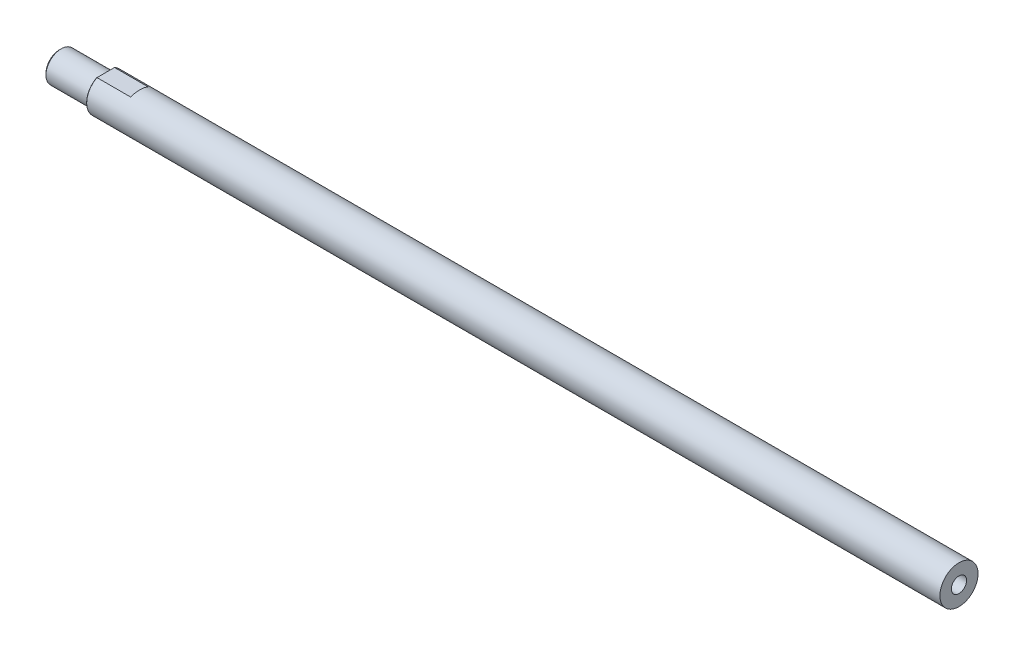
SolidWorks part; units mm, degrees
ref_plane "Front Plane" through (0, 0, 0) normal (0, 0, 1) x (1, 0, 0)
ref_plane "Top Plane" through (0, 0, 0) normal (0, 1, 0) x (1, 0, 0)
ref_plane "Right Plane" through (0, 0, 0) normal (1, 0, 0) x (0, 0, -1)
sketch "Sketch1" plane through (0, 0, 0) normal (0, 0, 1) x (1, 0, 0)
  line L0 (-34.7534, 0) -> (143.7331, 0) construction
  line L1 (-19.05, 6.35) -> (0, 6.35)
  line L2 (0, 6.35) -> (0, 7.9375)
  line L3 (0, 7.9375) -> (355.6, 7.9375)
  line L4 (355.6, 7.9375) -> (355.6, 0)
  line L5 (355.6, 0) -> (-19.05, 0)
  line L6 (-19.05, 0) -> (-19.05, 6.35)
  dimension "D1" = 12.7
  dimension "D2" = 15.875
  dimension "D3" = 19.05
  dimension "D4" = 355.6
revolve "Revolve1" add sketch "Sketch1" angle 360 about L0
hole_wizard "5/16-24 Tapped Hole1" positions "Sketch3" profile "Sketch2" tap size "5/16-24" standard "ANSI Inch"
sketch "Sketch3" plane through (-19.05, 0, 0) normal (-1, 0, 0) x (0, 0, 1)
  point P0 (0, 0)
sketch "Sketch2" plane through (-19.05, 0, 0) normal (0, 1, 0) x (0, 0, 1)
  line L0 (0, 0) -> (0, 17.9506)
  line L1 (0, 17.9506) -> (3.4544, 15.875)
  line L2 (3.4544, 15.875) -> (3.4544, 0)
  line L5 (3.4544, 0) -> (0, 0)
  line L10 (0, 17.9506) -> (-3.4544, 15.875) construction
  line L11 (0, -6.35) -> (0, 107.95) construction
  dimension "Tap Drill Dia." = 6.9088
  dimension "Tap Drill Depth" = 15.875
  dimension "Drill Angle" = 118
sketch "Sketch5" plane through (355.6, 0, 0) normal (1, 0, 0) x (0, 0, -1)
  circle A0 centre (0, 0) radius 3.175
  dimension "D1" = 6.35
extrude "Cut-Extrude1" cut sketch "Sketch5" against normal through all
sketch "Sketch6" plane through (0, 0, 0) normal (0, 0, 1) x (1, 0, 0)
  line L0 (0, 7.0485) -> (14.224, 7.0485)
  line L1 (0, 7.9375) -> (0, -7.9375) construction
  line L2 (14.224, 7.0485) -> (14.4622, 7.9375)
  line L3 (355.6, 7.9375) -> (0, 7.9375) construction
  line L4 (14.4622, 7.9375) -> (0, 7.9375)
  line L5 (0, 7.9375) -> (0, 7.0485)
  line L6 (0, -7.9375) -> (355.6, -7.9375) construction
  dimension "D1" = 75
  dimension "D2" = 14.986
  dimension "D3" = 14.224
extrude "Cut-Extrude2" cut sketch "Sketch6" against normal through all both and the other way through all
chamfer "Chamfer1" distance 0.762 angle 45 1 edges at (-19.05, 0, 6.35)
fillet "Fillet1" radius 0.381 1 edges at (0, 0, 6.35)
chamfer "Chamfer2" distance 0.254 angle 45 1 edges at (0, -7.9375, 0)
chamfer "Chamfer3" distance 0.254 angle 45 1 edges at (0, 7.0485, 0)
